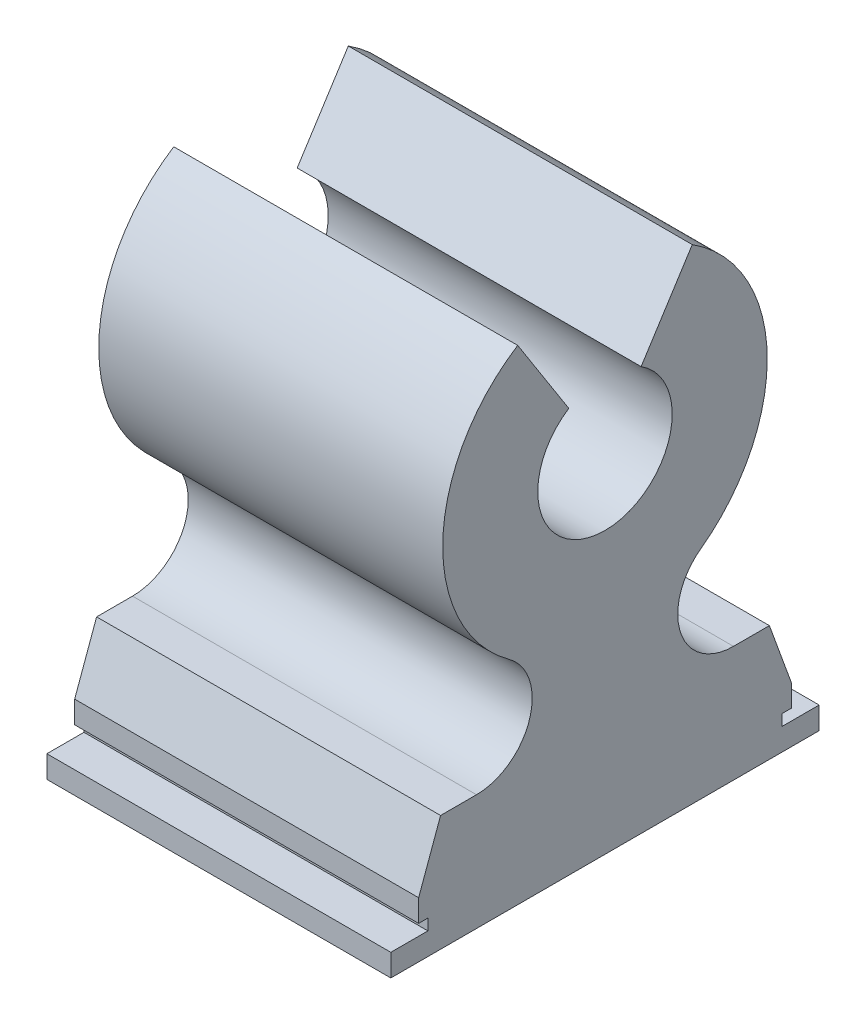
SolidWorks part; units mm, degrees
ref_plane "Plane1" through (0, 0, 0) normal (0, 0, 1) x (1, 0, 0)
ref_plane "Plane2" through (0, 0, 0) normal (0, 1, 0) x (1, 0, 0)
ref_plane "Plane3" through (0, 0, 0) normal (1, 0, 0) x (0, 0, -1)
sketch "BodySke" plane through (0, 0, 0) normal (1, 0, 0) x (0, 0, -1)
  line L0 (-5.8674, -9.525) -> (5.8674, -9.525)
  line L1 (5.8674, -9.525) -> (5.8674, -8.9154)
  line L2 (5.8674, -8.9154) -> (4.8514, -8.9154)
  line L3 (-5.8674, -9.525) -> (-5.8674, -8.9154)
  line L4 (-5.8674, -8.9154) -> (-4.8514, -8.9154)
  line L5 (4.8514, -8.9154) -> (4.8514, -8.6106)
  line L6 (-4.8514, -8.9154) -> (-4.8514, -8.6106)
  line L7 (4.8514, -8.6106) -> (5.1054, -8.6106)
  line L8 (-4.8514, -8.6106) -> (-5.1054, -8.6106)
  line L9 (-3.5204, -6.35) -> (-4.5045, -6.35)
  line L11 (4.5045, -6.35) -> (3.5204, -6.35)
  line L12 (0, 7.62) -> (0, -11.43) construction
  line L13 (7.62, 0) -> (-7.62, 0) construction
  line L14 (1.9939, -2.8908) -> (1.9939, -7.62) construction
  line L15 (-1.9939, -2.8908) -> (-1.9939, -7.62) construction
  line L16 (4.5045, -6.35) -> (5.1054, -8.001)
  line L17 (5.1054, -8.001) -> (5.1054, -8.6106)
  line L18 (-4.5045, -6.35) -> (-5.1054, -8.001)
  line L19 (-5.1054, -8.001) -> (-5.1054, -8.6106)
  line L20 (-0.9906, 1.5524) -> (-2.3911, 3.7471)
  line L21 (0.9906, 1.5524) -> (2.3911, 3.7471)
  arc A0 (-0.9906, 1.5524) -> (0.9906, 1.5524) centre (0, 0) ccw
  arc A1 (2.6205, -3.5904) -> (2.3911, 3.7471) centre (0, 0) ccw
  arc A2 (3.5204, -6.35) -> (2.6205, -3.5904) centre (3.5204, -4.8235) cw
  arc A3 (-2.6205, -3.5904) -> (-3.5204, -6.35) centre (-3.5204, -4.8235) cw
  arc A4 (-2.3911, 3.7471) -> (-2.6205, -3.5904) centre (0, 0) ccw
  dimension "Thread_min" = 3.683
  dimension "C_dia" = 8.89
  dimension "J_dim" = 3.9878
  dimension "E_dim" = 11.7348
  dimension "D_dim" = 3.175
  dimension "Clinch_ht" = 0.6096
  dimension "Side_ht" = 0.6096
  dimension "Groove_wid" = 0.3048
  dimension "A_dim" = 10.2108
  dimension "Groove_overall" = 9.7028
  dimension "F_dim" = 9.525
  dimension "D12" = 20
  dimension "H_dim" = 1.9812
extrude "Body" add sketch "BodySke" along normal blind 9.4234
equation "' \"Length@Body\" = 0.371"
equation "' \"A_dim@BodySke\" = 0.402"
equation "' \"C_dia@BodySke\" = 0.35"
equation "' \"D_dim@BodySke\" = 0.125"
equation "' \"E_dim@BodySke\" = 0.462"
equation "' \"F_dim@BodySke\" = 0.375"
equation "' \"H_dim@BodySke\" = 0.078"
equation "' \"J_dim@BodySke\" =  0.157"
equation "' \"Thread_min@BodySke\" = 0.145"
equation "\"Clinch_ht@BodySke\" = 0.04 * 0.6"
equation "\"Groove_wid@BodySke\" = \"Clinch_ht@BodySke\" / 2"
equation "\"Groove_overall@BodySke\" = \"A_dim@BodySke\" - ( \"E_dim@BodySke\" - \"A_dim@BodySke\") / 3"
equation "\"Side_ht@BodySke\" = \"Clinch_ht@BodySke\""
